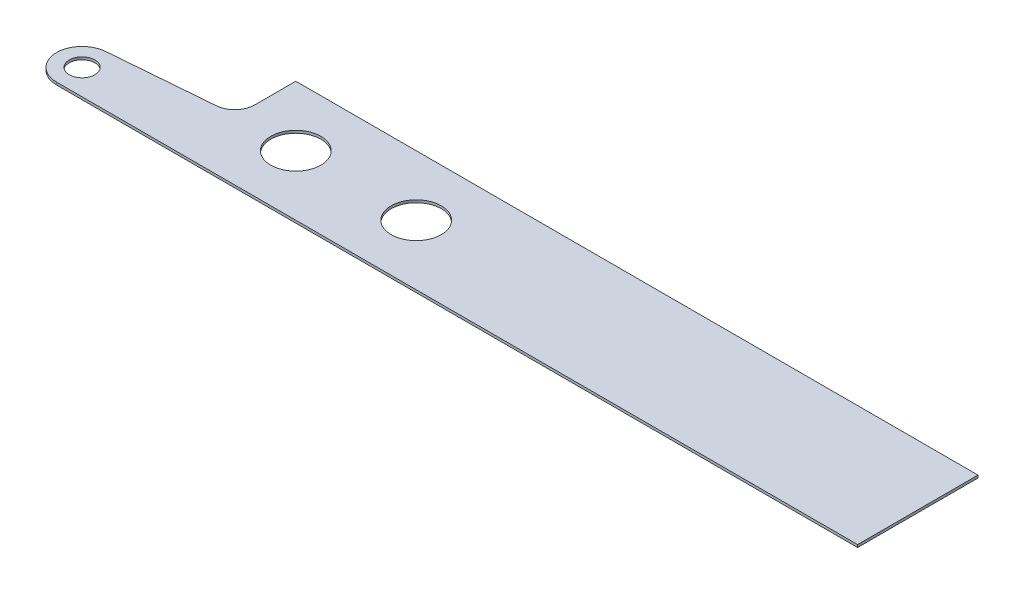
SolidWorks part; units mm, degrees
ref_plane "Front Plane" through (0, 0, 0) normal (0, 0, 1) x (1, 0, 0)
ref_plane "Top Plane" through (0, 0, 0) normal (0, 1, 0) x (1, 0, 0)
ref_plane "Right Plane" through (0, 0, 0) normal (1, 0, 0) x (0, 0, -1)
sketch "Sketch1" plane through (0, 0, 0) normal (0, 1, 0) x (1, 0, 0)
  line L0 (0, 0) -> (0, 14.9391) construction
  line L1 (-9.525, -4.7625) -> (9.525, -4.7625)
  line L2 (-9.525, -4.7625) -> (-9.525, 4.7625)
  line L3 (-9.525, 4.7625) -> (9.525, 4.7625)
  line L4 (9.525, -4.7625) -> (9.525, 4.7625)
  line L5 (-9.525, -4.7625) -> (9.525, 4.7625) construction
  line L6 (-9.525, 4.7625) -> (9.525, -4.7625) construction
  line L7 (0, 0) -> (-34.5199, 0) construction
  circle A0 centre (-4.7625, 0) radius 1.9812
  circle A1 centre (4.7625, 0) radius 1.9812
  point P0 (0, 0)
  dimension "D3" = 3.9624
  dimension "D4" = 9.525
  dimension "D1" = 9.525
  dimension "D2" = 19.05
extrude "Boss-Extrude1" add sketch "Sketch1" along normal blind 0.2032
sketch "Sketch2" plane through (0, 0.2032, 0) normal (0, 1, 0) x (1, 0, 0)
  line L0 (-9.525, -4.7625) -> (-18.9324, -4.7625)
  line L1 (-19.0965, -0.7239) -> (-10.9837, -0.0635)
  line L2 (-9.525, 4.7625) -> (-9.525, -4.7625) construction
  line L3 (-9.525, 1.5188) -> (-9.525, -4.7625)
  arc A0 (-18.9324, -4.7625) -> (-19.0965, -0.7239) centre (-18.9324, -2.7399) cw
  arc A1 (-10.9837, -0.0635) -> (-9.525, 1.5188) centre (-11.1125, 1.5188) ccw
  dimension "D4" = 1.5875
  dimension "D1" = 11.43
  dimension "D2" = 4.0386
  dimension "D3" = 4.699
extrude "Boss-Extrude2" add sketch "Sketch2" against normal blind 0.2032
sketch "Sketch3" plane through (0, 0.2032, 0) normal (0, 1, 0) x (1, 0, 0)
  circle A0 centre (-18.9324, -2.7399) radius 1.016
  dimension "D1" = 2.032
extrude "Cut-Extrude1" cut sketch "Sketch3" against normal through all
sketch "Sketch4" plane through (0, 0.2032, 0) normal (0, 1, 0) x (1, 0, 0)
  line L0 (-18.9324, -4.7625) -> (9.525, -4.7625) construction
  line L1 (9.525, 4.7625) -> (44.45, 4.7625)
  line L2 (9.525, 4.7625) -> (9.525, -4.7625)
  line L3 (9.525, -4.7625) -> (44.45, -4.7625)
  line L4 (44.45, 4.7625) -> (44.45, -4.7625)
  dimension "D1" = 34.925
extrude "Boss-Extrude3" add sketch "Sketch4" against normal blind 0.2032
sketch "Sketch5" plane through (0, 0, 0) normal (0, -1, 0) x (1, 0, 0)
  line L0 (35.8069, 1.0597) -> (33.6875, -1.0597)
  line L1 (44.45, 0) -> (38.6943, 0) construction
  line L2 (44.45, 4.7625) -> (44.45, -4.7625) construction
  line L3 (34.7472, 0) -> (34.7472, 6.7263) construction
  line L4 (9.525, 4.7625) -> (9.525, -4.7625) construction
  dimension "D1" = 45
  dimension "D2" = 2.9972
  dimension "D3" = 25.2222
extrude "Extrude-Thin1" add sketch "Sketch5" along normal blind 0.254 thin
fillet "Fillet1" radius 0.127 2 edges at (34.6574, -0.254, 0.0898) (34.837, -0.254, -0.0898)
